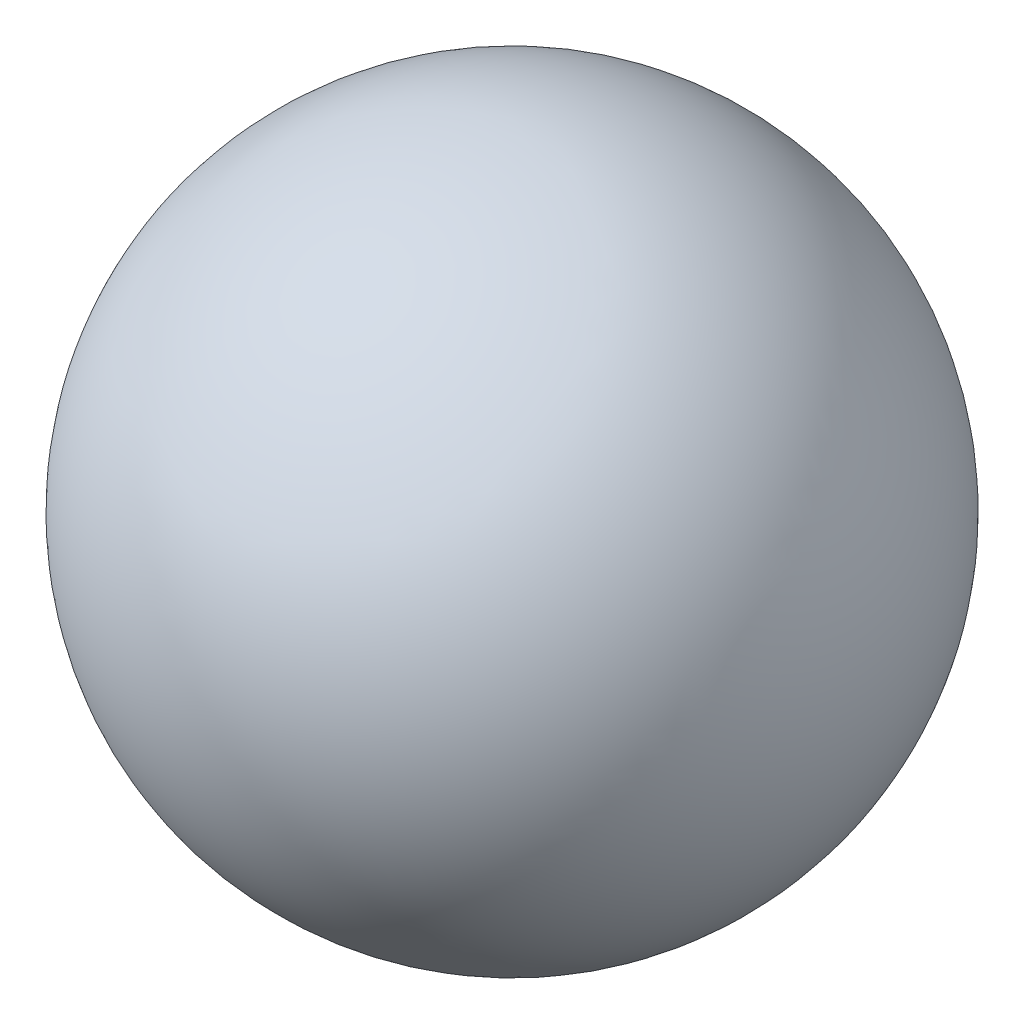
SolidWorks part; units mm, degrees
ref_plane "Front Plane" through (0, 0, 0) normal (0, 0, 1) x (1, 0, 0)
ref_plane "Top Plane" through (0, 0, 0) normal (0, 1, 0) x (1, 0, 0)
ref_plane "Right Plane" through (0, 0, 0) normal (1, 0, 0) x (0, 0, -1)
ref_plane "Plane4" through (0, 0, 0) normal (0, 0, 1) x (1, 0, 0)
sketch "Sketch1" plane through (0, 0, 0) normal (0, 0, 1) x (1, 0, 0)
  line L0 (5.3, 7.15) -> (1.7, 7.15)
  line L1 (49.9168, 7.15) -> (-50.0767, 7.15) construction
  arc A0 (1.7, 7.15) -> (5.3, 7.15) centre (3.5, 7.15) cw
  dimension "D1" = 1.8
  dimension "D2" = 7.15
  dimension "D3" = 3.5
revolve "Revolve1" add sketch "Sketch1" angle 360 about L1
